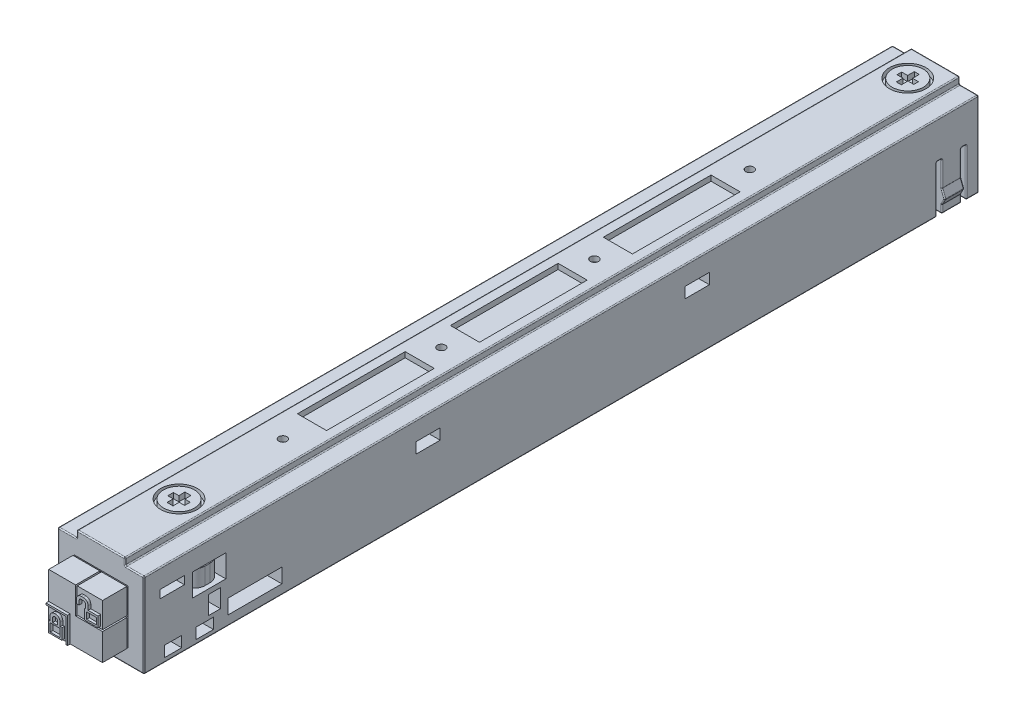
SolidWorks part; units mm, degrees
ref_plane "Płaszczyzna przednia" through (0, 0, 0) normal (0, 0, 1) x (1, 0, 0)
ref_plane "Płaszczyzna górna" through (0, 0, 0) normal (0, 1, 0) x (1, 0, 0)
ref_plane "Płaszczyzna prawa" through (0, 0, 0) normal (1, 0, 0) x (0, 0, -1)
sketch "Szkic2" plane through (0, 0, 0) normal (0, 0, 1) x (1, 0, 0)
  line L0 (4.5, 29.7607) -> (4.5, 28.4607)
  line L1 (-4.5, 29.7607) -> (4.5, 29.7607)
  line L2 (-8, 28.4607) -> (-8, 12.7607)
  line L3 (-8, 12.7607) -> (8, 12.7607)
  line L4 (8, 28.4607) -> (8, 12.7607)
  line L5 (-6.7765, 28.4607) -> (8, 12.7607) construction
  line L6 (-8, 12.7607) -> (6.7765, 28.4607) construction
  line L7 (4.5, 28.4607) -> (8, 28.4607)
  line L8 (0, 31.2078) -> (0, 10.088) construction
  line L9 (-4.5, 28.4607) -> (-8, 28.4607)
  line L10 (-4.5, 29.7607) -> (-4.5, 28.4607)
  point P0 (0, 21.2607)
  dimension "D3" = 1.3
  dimension "D4" = 3.5
extrude "Dodanie-wyciągnięcie2" add sketch "Szkic2" against normal blind 155 from offset 5 separate body
sketch "Szkic3" plane through (0, 0, -5) normal (0, 0, 1) x (1, 0, 0)
  line L0 (0, 25.5354) -> (0, 20.5354)
  line L1 (-5, 25.5354) -> (0, 25.5354)
  line L2 (-5, 25.5354) -> (-5, 15.5354)
  line L3 (-5, 15.5354) -> (5, 15.5354)
  line L4 (5, 25.5354) -> (5, 20.8368)
  line L5 (-5, 25.5354) -> (5, 15.5354) construction
  line L6 (-5, 15.5354) -> (5, 25.5354) construction
  line L7 (0, 20.5354) -> (5, 20.5354)
  line L8 (0.3014, 25.5354) -> (0.3014, 20.8368)
  line L9 (0.3014, 20.8368) -> (5, 20.8368)
  line L10 (0.3014, 25.5354) -> (5, 25.5354)
  line L11 (5, 20.5354) -> (5, 15.5354)
  point P0 (0, 20.5354)
  dimension "D1" = 10
  dimension "D2" = 10
extrude "Dodanie-wyciągnięcie3" add sketch "Szkic3" along normal blind 4.5 from offset 0.2 separate body
sketch "Szkic4" plane through (0, 12.7607, 0) normal (0, -1, 0) x (1, 0, 0)
  line L0 (-8, -160) -> (8, -160) construction
  circle A0 centre (0, -82.4) radius 6.65
  dimension "D1" = 13.3
  dimension "D2" = 77.6
extrude "Wytnij-wyciągnięcie1" cut sketch "Szkic4" against normal blind 5
sketch "Szkic5" plane through (0, 29.7607, 0) normal (0, 1, 0) x (1, 0, 0)
  line L0 (4.5, 160) -> (-4.5, 160) construction
  line L1 (2.7, 121) -> (-2.7, 121)
  line L2 (2.7, 121) -> (2.7, 101)
  line L3 (2.7, 101) -> (-2.7, 101)
  line L4 (-2.7, 121) -> (-2.7, 101)
  line L5 (2.7, 121) -> (-2.7, 101) construction
  line L6 (2.7, 101) -> (-2.7, 121) construction
  line L7 (2.7, 92.6) -> (-2.7, 92.6)
  line L8 (2.7, 92.6) -> (2.7, 72.6)
  line L9 (2.7, 72.6) -> (-2.7, 72.6)
  line L10 (-2.7, 92.6) -> (-2.7, 72.6)
  line L11 (2.7, 92.6) -> (-2.7, 72.6) construction
  line L12 (2.7, 72.6) -> (-2.7, 92.6) construction
  line L13 (2.7, 64.2) -> (-2.7, 64.2)
  line L14 (2.7, 64.2) -> (2.7, 44.2)
  line L15 (2.7, 44.2) -> (-2.7, 44.2)
  line L16 (-2.7, 64.2) -> (-2.7, 44.2)
  line L17 (2.7, 64.2) -> (-2.7, 44.2) construction
  line L18 (2.7, 44.2) -> (-2.7, 64.2) construction
  circle A0 centre (0, 125.5) radius 0.75
  circle A1 centre (0, 96.6416) radius 0.75
  circle A2 centre (0, 68.2363) radius 0.75
  circle A3 centre (0, 38.7968) radius 0.75
  point P0 (0, 111)
  point P5 (0, 82.6)
  point P10 (0, 54.2)
  dimension "D10" = 1.5
  dimension "D12" = 1.5
  dimension "D13" = 1.5
  dimension "D14" = 1.5
  dimension "D1" = 20
  dimension "D2" = 5.4
  dimension "D3" = 20
  dimension "D4" = 5.4
  dimension "D5" = 20
  dimension "D6" = 5.4
  dimension "D7" = 39
  dimension "D8" = 8.4
  dimension "D9" = 8.4
  dimension "D11" = 4.5
extrude "Wytnij-wyciągnięcie2" cut sketch "Szkic5" against normal blind 1
sketch "Szkic6" plane through (0, 29.7607, 0) normal (0, 1, 0) x (1, 0, 0)
  line L0 (4.5, 5) -> (-4.5, 5) construction
  line L1 (4.5, 160) -> (-4.5, 160) construction
  line L3 (0.4621, 156.5078) -> (-0.4621, 156.5078)
  line L4 (0.4621, 156.5078) -> (0.4621, 155.2723)
  line L5 (0.4621, 153.1722) -> (-0.4621, 153.1722)
  line L6 (-0.4621, 156.5078) -> (-0.4621, 155.2723)
  line L7 (0.4621, 156.5078) -> (0.1198, 155.2723) construction
  line L8 (0.4621, 153.1722) -> (0.1198, 154.4077) construction
  line L9 (1.5603, 155.2723) -> (0.4621, 155.2723)
  line L10 (1.5603, 155.2723) -> (1.5603, 154.4077)
  line L11 (1.5603, 154.4077) -> (0.4621, 154.4077)
  line L12 (-1.5603, 155.2723) -> (-1.5603, 154.4077)
  line L13 (-0.4621, 154.712) -> (-1.5603, 154.4077) construction
  line L15 (-0.1198, 154.4077) -> (-0.4621, 153.1722) construction
  line L16 (-0.4621, 155.2723) -> (-1.5603, 155.2723)
  line L19 (0.4621, 154.4077) -> (0.4621, 153.1722)
  line L20 (-0.4621, 154.4077) -> (-0.4621, 153.1722)
  line L21 (-0.4621, 154.4077) -> (-1.5603, 154.4077)
  line L22 (0.5592, 21.1724) -> (-0.5592, 21.1724)
  line L23 (0.5592, 21.1724) -> (0.5592, 20.0218)
  line L24 (0.5592, 17.8276) -> (-0.5592, 17.8276)
  line L25 (-0.5592, 21.1724) -> (-0.5592, 20.0218)
  line L26 (0, 19.5) -> (-0.1745, 18.9782) construction
  line L27 (0.5592, 17.8276) -> (0.1745, 18.9782) construction
  line L28 (1.5603, 20.0218) -> (0.5592, 20.0218)
  line L29 (1.5603, 20.0218) -> (1.5603, 18.9782)
  line L30 (1.5603, 18.9782) -> (0.5592, 18.9782)
  line L31 (-1.5603, 20.0218) -> (-1.5603, 18.9782)
  line L32 (0, 19.5) -> (-0.5592, 19.313) construction
  line L33 (0.5592, 19.313) -> (0, 19.5) construction
  line L34 (-0.5592, 20.0218) -> (-1.5603, 20.0218)
  line L35 (-0.1745, 20.0218) -> (-0.5592, 21.1724) construction
  line L36 (-0.5592, 18.9782) -> (-0.5592, 17.8276)
  line L37 (-0.5592, 19.687) -> (-1.5603, 20.0218) construction
  line L38 (-0.5592, 18.9782) -> (-1.5603, 18.9782)
  line L39 (0.5592, 18.9782) -> (0.5592, 17.8276)
  circle A0 centre (0, 154.84) radius 3.4
  circle A1 centre (0, 19.5) radius 3.4
  circle A2 centre (0, 154.84) radius 2.9
  circle A3 centre (0, 19.5) radius 2.9
  dimension "D1" = 6.8
  dimension "D3" = 6.8
  dimension "D2" = 14.5
  dimension "D4" = 5.16
  dimension "D5" = 0.5
extrude "Wytnij-wyciągnięcie3" cut sketch "Szkic6" against normal blind 1 contours L21 L20 L5 L19 L11 L10 L9 L4 L3 L6 L16 L12 | A0 A2 | L39 L30 L29 L28 L23 L22 L25 L34 L31 L38 L36 L24 | A1 A3
sketch "Szkic7" plane through (0, 0, -0.3) normal (0, 0, 1) x (1, 0, 0)
  line L0 (-3.7734, 17.8496) -> (-3.7734, 18.602)
  line L1 (-4.5441, 17.8496) -> (-4.2734, 17.8496)
  line L2 (-4.5441, 17.8496) -> (-4.5441, 15.8406)
  line L3 (-4.5441, 15.8406) -> (-2.0714, 15.8406)
  line L4 (-2.0714, 17.8496) -> (-2.0714, 15.8406)
  line L5 (-4.5441, 17.8496) -> (-2.0714, 15.8406) construction
  line L6 (-4.5441, 15.8406) -> (-2.0714, 17.8496) construction
  line L7 (-4.2318, 17.5959) -> (-2.3836, 17.5959)
  line L8 (-4.2318, 17.5959) -> (-4.2318, 16.0943)
  line L9 (-4.2318, 16.0943) -> (-2.3836, 16.0943)
  line L10 (-2.3836, 17.5959) -> (-2.3836, 16.0943)
  line L11 (-4.2318, 17.5959) -> (-2.3836, 16.0943) construction
  line L12 (-4.2318, 16.0943) -> (-2.3836, 17.5959) construction
  line L14 (-4.2734, 17.8496) -> (-4.2734, 18.602)
  line L15 (-3.3734, 19.502) -> (-3.2836, 19.502)
  line L16 (-2.3836, 17.8496) -> (-2.3836, 18.602)
  line L17 (-3.3734, 19.002) -> (-3.2836, 19.002)
  line L18 (-2.8836, 17.8496) -> (-2.8836, 18.602)
  line L19 (-3.7734, 17.8496) -> (-2.8836, 17.8496)
  line L20 (-2.3836, 17.8496) -> (-2.0714, 17.8496)
  line L21 (-5, 20.0711) -> (-1.2863, 20.0711)
  line L22 (-5, 25.5354) -> (-5, 15.5354) construction
  line L23 (-1.2863, 20.0711) -> (-1.2863, 15.5354)
  line L24 (-5, 15.5354) -> (5, 15.5354) construction
  line L25 (-1.2863, 15.5354) -> (-0.9982, 15.5354)
  line L26 (-0.9982, 15.5354) -> (-0.9982, 20.3855)
  line L27 (-0.9982, 20.3855) -> (-5, 20.3855)
  line L28 (-5, 20.3855) -> (-5, 20.0711)
  line L29 (2.3245, 23.108) -> (2.3245, 23.8307)
  line L30 (4.6585, 21.2181) -> (2.1886, 21.2181)
  line L31 (4.6585, 21.2181) -> (4.6585, 23.108)
  line L32 (4.6585, 23.108) -> (2.8245, 23.108)
  line L33 (2.1886, 21.2181) -> (2.1886, 23.108)
  line L34 (4.3592, 21.5362) -> (2.5441, 21.5362)
  line L35 (4.3592, 21.5362) -> (4.3592, 22.7337)
  line L36 (4.3592, 22.7337) -> (2.5441, 22.7337)
  line L37 (2.5441, 21.5362) -> (2.5441, 22.7337)
  line L39 (2.8245, 23.108) -> (2.8245, 23.8307)
  line L40 (1.9245, 24.7307) -> (1.5419, 24.7307)
  line L41 (0.6419, 23.108) -> (0.6419, 23.8307)
  line L42 (1.9245, 24.2307) -> (1.5419, 24.2307)
  line L43 (1.1419, 23.108) -> (1.1419, 23.8307)
  line L44 (1.1419, 23.108) -> (0.6419, 23.108)
  line L45 (2.3245, 23.108) -> (2.1886, 23.108)
  arc A0 (-3.2836, 19.502) -> (-2.3836, 18.602) centre (-3.2836, 18.602) cw
  arc A1 (-4.2734, 18.602) -> (-3.3734, 19.502) centre (-3.3734, 18.602) cw
  arc A2 (-3.7734, 18.602) -> (-3.3734, 19.002) centre (-3.3734, 18.602) cw
  arc A3 (-3.2836, 19.002) -> (-2.8836, 18.602) centre (-3.2836, 18.602) cw
  arc A4 (1.5419, 24.7307) -> (0.6419, 23.8307) centre (1.5419, 23.8307) ccw
  arc A5 (2.8245, 23.8307) -> (1.9245, 24.7307) centre (1.9245, 23.8307) ccw
  arc A6 (2.3245, 23.8307) -> (1.9245, 24.2307) centre (1.9245, 23.8307) ccw
  arc A7 (1.5419, 24.2307) -> (1.1419, 23.8307) centre (1.5419, 23.8307) ccw
  point P0 (-3.3077, 16.8451)
  point P5 (-3.3077, 16.8451)
  dimension "D1" = 0.9
  dimension "D3" = 0.9
  dimension "D2" = 0.5
  dimension "D4" = 0.5
extrude "Dodanie-wyciągnięcie4" add sketch "Szkic7" along normal blind 0.5
sketch "Szkic8" plane through (-8, 0, 0) normal (-1, 0, 0) x (0, 0, 1)
  line L0 (-160, 12.7607) -> (-5, 12.7607) construction
  line L1 (-157.7, 12.7607) -> (-152.2, 12.7607)
  line L2 (-157.7, 12.7607) -> (-157.7, 21.5607)
  line L3 (-157.7, 21.5607) -> (-152.2, 21.5607)
  line L4 (-152.2, 12.7607) -> (-152.2, 21.5607)
  line L5 (-160, 28.4607) -> (-160, 12.7607) construction
  line L6 (-110, 24.9607) -> (-105.5, 24.9607)
  line L7 (-110, 24.9607) -> (-110, 22.9607)
  line L8 (-110, 22.9607) -> (-105.5, 22.9607)
  line L9 (-105.5, 24.9607) -> (-105.5, 22.9607)
  line L10 (-60, 24.9607) -> (-55.5, 24.9607)
  line L11 (-60, 24.9607) -> (-60, 22.9607)
  line L12 (-60, 22.9607) -> (-55.5, 22.9607)
  line L13 (-55.5, 24.9607) -> (-55.5, 22.9607)
  line L14 (-30.6, 17.2607) -> (-20.6, 17.2607)
  line L15 (-30.6, 17.2607) -> (-30.6, 14.5607)
  line L16 (-30.6, 14.5607) -> (-20.6, 14.5607)
  line L17 (-20.6, 17.2607) -> (-20.6, 14.5607)
  line L18 (-17.9, 15.5625) -> (-14.7, 15.5625)
  line L19 (-17.9, 15.5625) -> (-17.9, 13.5625)
  line L20 (-17.9, 13.5625) -> (-14.7, 13.5625)
  line L21 (-14.7, 15.5625) -> (-14.7, 13.5625)
  line L22 (-12, 15.5811) -> (-8.8, 15.5811)
  line L23 (-12, 15.5811) -> (-12, 13.5811)
  line L24 (-12, 13.5811) -> (-8.8, 13.5811)
  line L25 (-8.8, 15.5811) -> (-8.8, 13.5811)
  line L26 (-19.2, 19.6607) -> (-17, 19.6607)
  line L27 (-19.2, 19.6607) -> (-19.2, 16.2607)
  line L28 (-19.2, 16.2607) -> (-17, 16.2607)
  line L29 (-17, 19.6607) -> (-17, 16.2607)
  line L30 (-20.2, 24.7607) -> (-14, 24.7607)
  line L31 (-20.2, 24.7607) -> (-20.2, 20.5607)
  line L32 (-20.2, 20.5607) -> (-14, 20.5607)
  line L33 (-14, 24.7607) -> (-14, 20.5607)
  line L34 (-12.5, 24.9607) -> (-8, 24.9607)
  line L35 (-12.5, 24.9607) -> (-12.5, 23.4607)
  line L36 (-12.5, 23.4607) -> (-8, 23.4607)
  line L37 (-8, 24.9607) -> (-8, 23.4607)
  line L39 (-160, 28.4607) -> (-5, 28.4607) construction
  line L40 (-160, 28.4607) -> (-5, 28.4607) construction
  line L41 (-5, 28.4607) -> (-5, 12.7607) construction
  dimension "D1" = 8.8
  dimension "D2" = 5.5
  dimension "D3" = 2.3
  dimension "D4" = 4.5
  dimension "D5" = 2
  dimension "D6" = 50
  dimension "D7" = 3.5
  dimension "D8" = 4.5
  dimension "D9" = 2
  dimension "D10" = 3.5
  dimension "D11" = 45.5
  dimension "D12" = 4.5
  dimension "D13" = 1.5
  dimension "D14" = 3.5
  dimension "D15" = 6.2
  dimension "D16" = 4.2
  dimension "D17" = 3.7
  dimension "D18" = 9
  dimension "D19" = 3
  dimension "D20" = 3.4
  dimension "D21" = 2.2
  dimension "D22" = 8.8
  dimension "D23" = 12
  dimension "D24" = 3.2
  dimension "D25" = 2
  dimension "D26" = 3.8
  dimension "D27" = 10
  dimension "D28" = 3.2
  dimension "D29" = 2
  dimension "D30" = 2.7
  dimension "D31" = 2.7
  dimension "D32" = 2.7
  dimension "D33" = 1.8
extrude "Wytnij-wyciągnięcie4" cut sketch "Szkic8" against normal blind 3.3
ref_plane "Płaszczyzna1" through (0, 0, -154.95) normal (0, 0, 1) x (1, 0, 0)
sketch "Szkic9" plane through (0, 0, -154.95) normal (0, 0, 1) x (1, 0, 0)
  line L1 (-8, 21.5607) -> (-8, 16.8739)
  line L2 (-8, 28.4607) -> (-8, 12.7607) construction
  line L3 (-8, 16.8739) -> (-8.5971, 15.3499)
  line L4 (-8.5971, 15.3499) -> (-8, 14.2432)
  line L6 (-6.2748, 14.2432) -> (-6.2748, 21.5607)
  line L7 (-4.7, 21.5607) -> (-8, 21.5607) construction
  line L8 (-6.2748, 21.5607) -> (-8, 21.5607)
  line L9 (-8, 14.2432) -> (-8, 12.7768)
  line L10 (-8, 12.7768) -> (-6.2748, 12.7768)
  line L11 (-6.2748, 12.7768) -> (-6.2748, 14.2432)
extrude "Dodanie-wyciągnięcie5" add sketch "Szkic9" along normal blind 1.8 and the other way blind 1.8
sketch "Szkic10" plane through (-4.7, 0, 0) normal (-1, 0, 0) x (0, 0, 1)
  line L1 (-19.5647, 24.249) -> (-14.6172, 24.249)
  line L2 (-19.5647, 24.249) -> (-19.5647, 21.1077)
  line L3 (-19.5647, 21.1077) -> (-14.6172, 21.1077)
  line L4 (-14.6172, 24.249) -> (-14.6172, 21.1077)
extrude "Dodanie-wyciągnięcie6" add sketch "Szkic10" along normal blind 3 separate body
fillet "Zaokrąglenie1" radius 2 2 edges at (-7.7, 22.6783, -14.6172) (-7.7, 22.6783, -19.5647)
mirror "Lustro3" about plane through (0, 0, 0) normal (1, 0, 0) of "Dodanie-wyciągnięcie5", "Wytnij-wyciągnięcie4"
mirror "Lustro4" about plane through (0, 0, 0) normal (1, 0, 0)
fillet "Zaokrąglenie3" radius 0.2 90 edges at (8, 13.51, -153.15) (8, 14.2432, -154.95) (8, 12.7768, -154.95) (8, 13.51, -156.75) (8.2985, 14.7966, -153.15) (7.1374, 12.7768, -153.15) (8.2985, 14.7966, -156.75) (8.5971, 15.3499, -154.95) (6.2748, 12.7768, -154.95) (7.1374, 12.7768, -156.75) (8.2985, 16.1119, -153.15) (6.2748, 17.1687, -153.15) (8.2985, 16.1119, -156.75) (8, 16.8739, -154.95) (6.2748, 21.5607, -154.95) (6.2748, 17.1687, -156.75) (8, 19.2173, -153.15) (7.1374, 21.5607, -153.15) (8, 19.2173, -156.75) (7.1374, 21.5607, -156.75) (4.7, 21.5607, -154.95) (4.5, 29.7607, -82.5) (4.5, 29.1107, -5) (4.7, 17.1607, -152.2) (8, 21.5607, -152.675) (6.35, 21.5607, -152.2) (0, 29.7607, -5) (4.5, 29.1107, -160) (4.5, 28.4607, -82.5) (6.35, 21.5607, -157.7) (8, 21.5607, -157.225) (4.7, 17.1607, -157.7) (4.7, 12.7607, -154.95) (0, 29.7607, -160) (-4.5, 29.7607, -82.5) (6.25, 28.4607, -5) (6.35, 12.7607, -152.2) (8, 17.1607, -152.2) (-4.5, 29.1107, -5) (6.25, 28.4607, -160) (8, 28.4607, -82.5) (8, 17.1607, -157.7) (6.35, 12.7607, -157.7) (-4.5, 29.1107, -160) (-4.5, 28.4607, -82.5) (8, 20.6107, -5) (8, 12.7607, -78.6) (-6.25, 28.4607, -5) (8, 20.6107, -160) (8, 12.7607, -158.85) (-6.25, 28.4607, -160) (-8, 28.4607, -82.5) (0, 12.7607, -5) (-8, 20.6107, -5) (0, 12.7607, -160) (-8, 20.6107, -160) (-4.7, 12.7607, -154.95) (-8, 12.7607, -78.6) (-6.35, 12.7607, -152.2) (-4.7, 17.1607, -152.2) (-7.1374, 12.7768, -153.15) (-8, 12.7768, -154.95) (-8, 12.7607, -158.85) (-6.35, 12.7607, -157.7) (-4.7, 21.5607, -154.95) (-4.7, 17.1607, -157.7) (-7.1374, 12.7768, -156.75) (-6.2748, 12.7768, -154.95) (-8, 13.51, -153.15) (-8, 17.1607, -152.2) (-6.35, 21.5607, -152.2) (-6.2748, 17.1687, -153.15) (-8, 13.51, -156.75) (-8, 14.2432, -154.95) (-8, 17.1607, -157.7) (-6.35, 21.5607, -157.7) (-6.2748, 21.5607, -154.95) (-6.2748, 17.1687, -156.75) (-8.2985, 14.7966, -153.15) (-8, 21.5607, -152.675) (-7.1374, 21.5607, -153.15) (-8.2985, 14.7966, -156.75) (-8.5971, 15.3499, -154.95) (-8, 21.5607, -157.225) (-7.1374, 21.5607, -156.75) (-8.2985, 16.1119, -153.15) (-8, 19.2173, -153.15) (-8.2985, 16.1119, -156.75) (-8, 19.2173, -156.75) (-8, 16.8739, -154.95)
sketch "Szkic11" plane through (0, 0, -5) normal (0, 0, 1) x (1, 0, 0)
  line L1 (-5, 25.5354) -> (5, 25.5354)
  line L2 (-5, 25.5354) -> (-5, 15.5354)
  line L3 (-5, 15.5354) -> (5, 15.5354)
  line L4 (5, 25.5354) -> (5, 15.5354)
extrude "Wytnij-wyciągnięcie5" cut sketch "Szkic11" against normal blind 5
